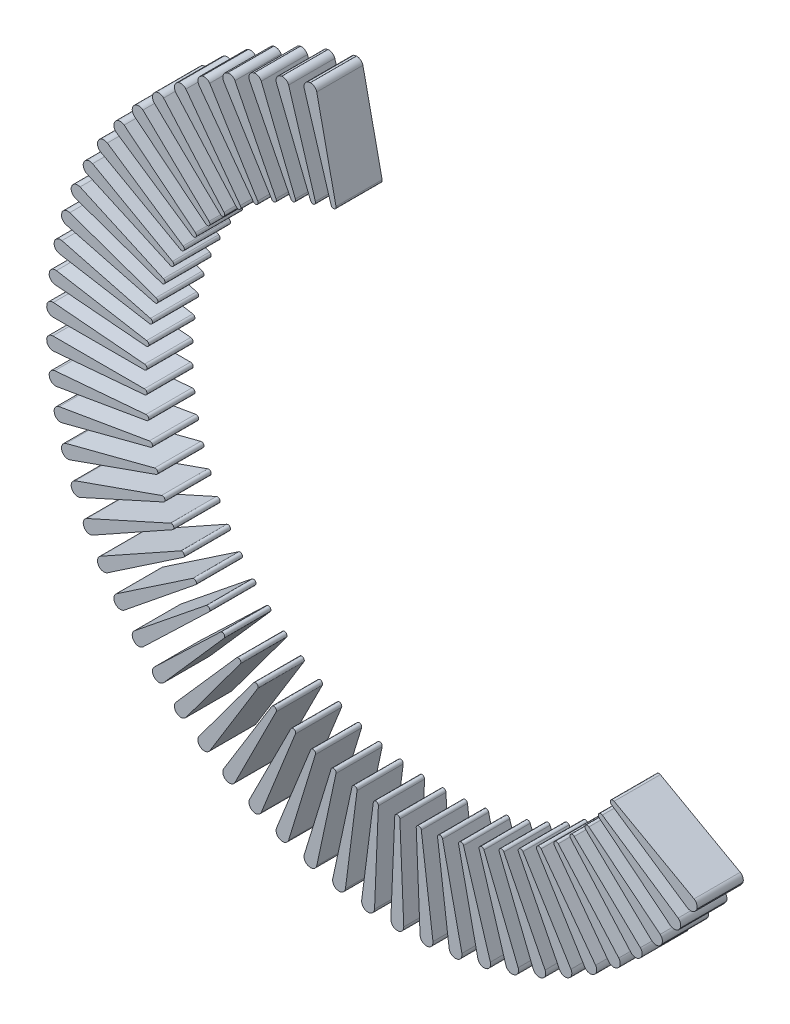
SolidWorks part; units mm, degrees
ref_plane "Přední rovina" through (0, 0, 0) normal (0, 0, 1) x (1, 0, 0)
ref_plane "Horní rovina" through (0, 0, 0) normal (0, 1, 0) x (1, 0, 0)
ref_plane "Pravá rovina" through (0, 0, 0) normal (1, 0, 0) x (0, 0, -1)
sketch "Skica1" plane through (0, 0, 0) normal (0, 0, 1) x (1, 0, 0)
  line L0 (-0.0007, 94.0554) -> (-0.0007, -97.5291) construction
  line L1 (-111.4898, -0.3887) -> (131.9321, -0.3887) construction
  line L2 (-0.0007, 77.5113) -> (-0.0007, 75.987)
  line L3 (-0.3207, 75.987) -> (0.3193, 75.987)
  line L4 (0.3193, 75.987) -> (0.3193, 75.977)
  line L5 (-0.0007, 76.0441) -> (-0.0007, 74.6141)
  line L6 (-0.0007, 74.6141) -> (-0.0007, 54.8141)
  line L7 (1.3993, 74.6141) -> (0.5493, 54.8141)
  line L8 (-1.4007, 74.6141) -> (-0.5507, 54.8141)
  line L9 (-0.3207, 75.987) -> (-0.3207, 75.977)
  line L10 (4.9321, 74.4641) -> (4.0999, 54.6633)
  line L11 (7.722, 74.2266) -> (5.1959, 54.57)
  line L12 (6.7623, 75.6862) -> (6.7615, 75.6762)
  line L13 (6.1246, 75.7405) -> (6.1238, 75.7305)
  line L14 (6.1246, 75.7405) -> (6.7623, 75.6862)
  line L15 (11.2293, 73.7776) -> (8.7209, 54.1187)
  line L16 (13.989, 73.3044) -> (9.8051, 53.9328)
  line L17 (13.1566, 74.8401) -> (13.1549, 74.8302)
  line L18 (12.5258, 74.9482) -> (12.5241, 74.9384)
  line L19 (12.5258, 74.9482) -> (13.1566, 74.8401)
  line L20 (17.4456, 72.5595) -> (13.279, 53.1842)
  line L21 (20.1553, 71.8539) -> (14.3436, 52.907)
  line L22 (19.4561, 73.4547) -> (19.4536, 73.445)
  line L23 (18.8367, 73.616) -> (18.8342, 73.6063)
  line L24 (18.8367, 73.616) -> (19.4561, 73.4547)
  line L25 (23.5363, 70.8186) -> (17.7415, 51.8664)
  line L26 (26.1763, 69.8858) -> (18.7787, 51.5)
  line L27 (25.6154, 71.5401) -> (25.6121, 71.5307)
  line L28 (25.012, 71.7533) -> (25.0086, 71.7439)
  line L29 (25.012, 71.7533) -> (25.6154, 71.5401)
  line L30 (29.4573, 68.5674) -> (22.0762, 50.175)
  line L31 (32.0087, 67.4141) -> (23.0786, 49.7219)
  line L32 (31.5901, 69.11) -> (31.586, 69.1009)
  line L33 (31.007, 69.3736) -> (31.0028, 69.3645)
  line L34 (31.007, 69.3736) -> (31.5901, 69.11)
  line L35 (35.1661, 65.8223) -> (26.2518, 48.122)
  line L36 (37.6106, 64.4567) -> (27.2121, 47.5856)
  line L37 (37.3373, 66.182) -> (37.3324, 66.1733)
  line L38 (36.7785, 66.4941) -> (36.7737, 66.4854)
  line L39 (36.7785, 66.4941) -> (37.3373, 66.182)
  line L40 (40.6215, 62.6028) -> (30.2383, 45.7224)
  line L41 (42.9414, 61.0349) -> (31.1496, 45.1064)
  line L42 (42.8154, 62.7772) -> (42.8098, 62.7689)
  line L43 (42.2851, 63.1356) -> (42.2795, 63.1273)
  line L44 (42.2851, 63.1356) -> (42.8154, 62.7772)
  line L45 (45.7843, 58.9324) -> (34.0069, 42.9933)
  line L46 (47.9628, 57.1733) -> (34.8627, 42.3022)
  line L47 (47.985, 58.92) -> (47.9787, 58.9122)
  line L48 (47.4871, 59.3221) -> (47.4808, 59.3143)
  line L49 (47.4871, 59.3221) -> (47.985, 58.92)
  line L50 (50.6172, 54.8373) -> (37.5304, 39.9544)
  line L51 (52.6386, 52.8999) -> (38.3246, 39.1933)
  line L52 (52.8089, 54.6383) -> (52.802, 54.6311)
  line L53 (52.3469, 55.0812) -> (52.34, 55.074)
  line L54 (52.3469, 55.0812) -> (52.8089, 54.6383)
  line L55 (55.0853, 50.3471) -> (40.7836, 36.6277)
  line L56 (56.9352, 48.2452) -> (41.5104, 35.8019)
  line L57 (57.2523, 49.963) -> (57.2448, 49.9564)
  line L58 (56.8295, 50.4434) -> (56.822, 50.4368)
  line L59 (56.8295, 50.4434) -> (57.2523, 49.963)
  line L60 (59.1566, 45.4942) -> (43.7429, 33.037)
  line L61 (60.8216, 43.243) -> (44.397, 32.1526)
  line L62 (61.2832, 44.9277) -> (61.2752, 44.9217)
  line L63 (60.9027, 45.4422) -> (60.8946, 45.4363)
  line L64 (60.9027, 45.4422) -> (61.2832, 44.9277)
  line L65 (62.8017, 40.3134) -> (46.3871, 29.2083)
  line L66 (64.2698, 37.9291) -> (46.9638, 28.2717)
  line L67 (64.8726, 39.5686) -> (64.8641, 39.5634)
  line L68 (64.537, 40.1136) -> (64.5285, 40.1084)
  line L69 (64.537, 40.1136) -> (64.8726, 39.5686)
  line L70 (65.9943, 34.8422) -> (48.697, 25.1692)
  line L71 (67.2548, 32.342) -> (49.1922, 24.187)
  line L72 (67.9946, 33.9245) -> (67.9856, 33.92)
  line L73 (67.7064, 34.496) -> (67.6975, 34.4915)
  line L74 (67.7064, 34.496) -> (67.9946, 33.9245)
  line L75 (68.7114, 29.12) -> (50.6561, 20.9488)
  line L76 (69.7554, 26.5219) -> (51.0662, 19.9281)
  line L77 (70.6266, 28.036) -> (70.6173, 28.0322)
  line L78 (70.388, 28.6298) -> (70.3787, 28.6261)
  line L79 (70.388, 28.6298) -> (70.6266, 28.036)
  line L80 (70.9334, 23.188) -> (52.2502, 16.5773)
  line L81 (71.7533, 20.5107) -> (52.5723, 15.5256)
  line L82 (72.7498, 21.9454) -> (72.7402, 21.9425)
  line L83 (72.5624, 22.5573) -> (72.5528, 22.5544)
  line L84 (72.5624, 22.5573) -> (72.7498, 21.9454)
  line L85 (72.6443, 17.0889) -> (53.4678, 12.0865)
  line L86 (73.2342, 14.3517) -> (53.6995, 11.0112)
  line L87 (74.3488, 15.6967) -> (74.339, 15.6946)
  line L88 (74.214, 16.3224) -> (74.2042, 16.3203)
  line L89 (74.214, 16.3224) -> (74.3488, 15.6967)
  line L90 (73.8318, 10.8666) -> (54.3002, 7.5086)
  line L91 (74.1875, 8.0893) -> (54.4399, 6.4175)
  line L92 (75.4121, 9.335) -> (75.4022, 9.3337)
  line L93 (75.3308, 9.9698) -> (75.3209, 9.9685)
  line L94 (75.3308, 9.9698) -> (75.4121, 9.335)
  line L95 (74.4874, 4.5661) -> (54.7413, 2.8766)
  line L96 (74.6063, 1.7686) -> (54.788, 1.7775)
  line L97 (75.9321, 2.9059) -> (75.9221, 2.9055)
  line L98 (75.905, 3.5454) -> (75.895, 3.5449)
  line L99 (75.905, 3.5454) -> (75.9321, 2.9059)
  line L100 (74.6063, -1.7673) -> (54.7881, -1.7762)
  line L101 (74.4875, -4.5648) -> (54.7414, -2.8752)
  line L102 (75.905, -3.544) -> (75.895, -3.5436)
  line L103 (75.9322, -2.9046) -> (75.9222, -2.9042)
  line L104 (75.9322, -2.9046) -> (75.905, -3.544)
  line L105 (74.1877, -8.088) -> (54.4401, -6.4162)
  line L106 (73.832, -10.8653) -> (54.3004, -7.5072)
  line L107 (75.331, -9.9685) -> (75.3211, -9.9672)
  line L108 (75.4123, -9.3336) -> (75.4024, -9.3324)
  line L109 (75.4123, -9.3336) -> (75.331, -9.9685)
  line L110 (73.2345, -14.3504) -> (53.6998, -11.0099)
  line L111 (72.6446, -17.0876) -> (53.4681, -12.0852)
  line L112 (74.2142, -16.3211) -> (74.2045, -16.3189)
  line L113 (74.3491, -15.6954) -> (74.3393, -15.6933)
  line L114 (74.3491, -15.6954) -> (74.2142, -16.3211)
  line L115 (71.7537, -20.5094) -> (52.5727, -15.5243)
  line L116 (70.9338, -23.1867) -> (52.2506, -16.5761)
  line L117 (72.5628, -22.5561) -> (72.5532, -22.5531)
  line L118 (72.7502, -21.9441) -> (72.7406, -21.9412)
  line L119 (72.7502, -21.9441) -> (72.5628, -22.5561)
  line L120 (69.7559, -26.5207) -> (51.0667, -19.9268)
  line L121 (68.7119, -29.1188) -> (50.6566, -20.9475)
  line L122 (70.3885, -28.6286) -> (70.3792, -28.6248)
  line L123 (70.6271, -28.0347) -> (70.6178, -28.031)
  line L124 (70.6271, -28.0347) -> (70.3885, -28.6286)
  line L125 (67.2554, -32.3409) -> (49.1928, -24.1858)
  line L126 (65.9949, -34.841) -> (48.6976, -25.168)
  line L127 (67.707, -34.4948) -> (67.6981, -34.4903)
  line L128 (67.9952, -33.9233) -> (67.9862, -33.9188)
  line L129 (67.9952, -33.9233) -> (67.707, -34.4948)
  line L130 (64.2705, -37.928) -> (46.9645, -28.2705)
  line L131 (62.8024, -40.3123) -> (46.3878, -29.2072)
  line L132 (64.5377, -40.1125) -> (64.5292, -40.1072)
  line L133 (64.8733, -39.5675) -> (64.8648, -39.5623)
  line L134 (64.8733, -39.5675) -> (64.5377, -40.1125)
  line L135 (60.8224, -43.2419) -> (44.3978, -32.1515)
  line L136 (59.1574, -45.4931) -> (43.7437, -33.0359)
  line L137 (60.9035, -45.4412) -> (60.8954, -45.4352)
  line L138 (61.284, -44.9266) -> (61.276, -44.9206)
  line L139 (61.284, -44.9266) -> (60.9035, -45.4412)
  line L140 (56.9361, -48.2442) -> (41.5112, -35.8009)
  line L141 (55.0862, -50.3461) -> (40.7845, -36.6267)
  line L142 (56.8304, -50.4424) -> (56.8229, -50.4358)
  line L143 (57.2532, -49.962) -> (57.2457, -49.9554)
  line L144 (57.2532, -49.962) -> (56.8304, -50.4424)
  line L145 (52.6396, -52.8989) -> (38.3256, -39.1923)
  line L146 (50.6181, -54.8364) -> (37.5314, -39.9535)
  line L147 (52.3478, -55.0803) -> (52.3409, -55.073)
  line L148 (52.8099, -54.6374) -> (52.803, -54.6302)
  line L149 (52.8099, -54.6374) -> (52.3478, -55.0803)
  line L150 (47.9638, -57.1725) -> (34.8638, -42.3014)
  line L151 (45.7853, -58.9315) -> (34.0079, -42.9924)
  line L152 (47.4881, -59.3212) -> (47.4818, -59.3135)
  line L153 (47.9861, -58.9192) -> (47.9798, -58.9114)
  line L154 (47.9861, -58.9192) -> (47.4881, -59.3212)
  line L155 (42.9425, -61.0342) -> (31.1507, -45.1056)
  line L156 (40.6227, -62.6021) -> (30.2394, -45.7216)
  line L157 (42.2863, -63.1348) -> (42.2807, -63.1265)
  line L158 (42.8165, -62.7764) -> (42.8109, -62.7681)
  line L159 (42.8165, -62.7764) -> (42.2863, -63.1348)
  line L160 (37.6117, -64.4561) -> (27.2133, -47.5849)
  line L161 (35.1673, -65.8216) -> (26.253, -48.1214)
  line L162 (36.7797, -66.4935) -> (36.7748, -66.4848)
  line L163 (37.3384, -66.1814) -> (37.3336, -66.1726)
  line L164 (37.3384, -66.1814) -> (36.7797, -66.4935)
  line L165 (32.01, -67.4136) -> (23.0798, -49.7213)
  line L166 (29.4585, -68.5669) -> (22.0774, -50.1744)
  line L167 (31.0082, -69.3731) -> (31.0041, -69.364)
  line L168 (31.5914, -69.1095) -> (31.5872, -69.1004)
  line L169 (31.5914, -69.1095) -> (31.0082, -69.3731)
  line L170 (26.1776, -69.8853) -> (18.78, -51.4995)
  line L171 (23.5375, -70.8181) -> (17.7428, -51.866)
  line L172 (25.0132, -71.7528) -> (25.0099, -71.7434)
  line L173 (25.6167, -71.5396) -> (25.6133, -71.5302)
  line L174 (25.6167, -71.5396) -> (25.0132, -71.7528)
  line L175 (20.1566, -71.8536) -> (14.3449, -52.9067)
  line L176 (17.4469, -72.5591) -> (13.2803, -53.1838)
  line L177 (18.838, -73.6156) -> (18.8355, -73.6059)
  line L178 (19.4574, -73.4544) -> (19.4549, -73.4447)
  line L179 (19.4574, -73.4544) -> (18.838, -73.6156)
  line L180 (13.9904, -73.3041) -> (9.8064, -53.9326)
  line L181 (11.2306, -73.7773) -> (8.7222, -54.1185)
  line L182 (12.5271, -74.948) -> (12.5254, -74.9381)
  line L183 (13.1579, -74.8398) -> (13.1562, -74.83)
  line L184 (13.1579, -74.8398) -> (12.5271, -74.948)
  line L185 (7.7233, -74.2265) -> (5.1972, -54.5699)
  line L186 (4.9334, -74.464) -> (4.1012, -54.6632)
  line L187 (6.126, -75.7404) -> (6.1251, -75.7304)
  line L188 (6.7637, -75.6861) -> (6.7628, -75.6761)
  line L189 (6.7637, -75.6861) -> (6.126, -75.7404)
  line L190 (1.4007, -74.6141) -> (0.5507, -54.8141)
  line L191 (-1.3993, -74.6141) -> (-0.5493, -54.8141)
  line L192 (-0.3193, -75.987) -> (-0.3193, -75.977)
  line L193 (0.3207, -75.987) -> (0.3207, -75.977)
  line L194 (0.3207, -75.987) -> (-0.3193, -75.987)
  line L195 (-4.9321, -74.4641) -> (-4.0999, -54.6633)
  line L196 (-7.722, -74.2266) -> (-5.1959, -54.57)
  line L197 (-6.7623, -75.6862) -> (-6.7615, -75.6762)
  line L198 (-6.1246, -75.7405) -> (-6.1238, -75.7305)
  line L199 (-6.1246, -75.7405) -> (-6.7623, -75.6862)
  line L200 (-11.2293, -73.7776) -> (-8.7209, -54.1187)
  line L201 (-13.989, -73.3044) -> (-9.8051, -53.9328)
  line L202 (-13.1566, -74.8401) -> (-13.1549, -74.8302)
  line L203 (-12.5258, -74.9482) -> (-12.5241, -74.9384)
  line L204 (-12.5258, -74.9482) -> (-13.1566, -74.8401)
  line L205 (-17.4456, -72.5595) -> (-13.279, -53.1842)
  line L206 (-20.1553, -71.8539) -> (-14.3436, -52.907)
  line L207 (-19.4561, -73.4547) -> (-19.4536, -73.445)
  line L208 (-18.8367, -73.616) -> (-18.8342, -73.6063)
  line L209 (-18.8367, -73.616) -> (-19.4561, -73.4547)
  line L210 (-23.5363, -70.8186) -> (-17.7415, -51.8664)
  line L211 (-26.1763, -69.8858) -> (-18.7787, -51.5)
  line L212 (-25.6154, -71.5401) -> (-25.6121, -71.5307)
  line L213 (-25.012, -71.7533) -> (-25.0086, -71.7439)
  line L214 (-25.012, -71.7533) -> (-25.6154, -71.5401)
  line L215 (-29.4573, -68.5674) -> (-22.0762, -50.175)
  line L216 (-32.0087, -67.4141) -> (-23.0786, -49.7219)
  line L217 (-31.5901, -69.11) -> (-31.586, -69.1009)
  line L218 (-31.007, -69.3736) -> (-31.0028, -69.3645)
  line L219 (-31.007, -69.3736) -> (-31.5901, -69.11)
  line L220 (-35.1661, -65.8223) -> (-26.2518, -48.122)
  line L221 (-37.6106, -64.4567) -> (-27.2121, -47.5856)
  line L222 (-37.3373, -66.182) -> (-37.3324, -66.1733)
  line L223 (-36.7785, -66.4941) -> (-36.7737, -66.4854)
  line L224 (-36.7785, -66.4941) -> (-37.3373, -66.182)
  line L225 (-40.6215, -62.6028) -> (-30.2383, -45.7224)
  line L226 (-42.9414, -61.0349) -> (-31.1496, -45.1064)
  line L227 (-42.8154, -62.7772) -> (-42.8098, -62.7689)
  line L228 (-42.2851, -63.1356) -> (-42.2795, -63.1273)
  line L229 (-42.2851, -63.1356) -> (-42.8154, -62.7772)
  line L230 (-45.7843, -58.9324) -> (-34.0069, -42.9933)
  line L231 (-47.9628, -57.1733) -> (-34.8627, -42.3022)
  line L232 (-47.985, -58.92) -> (-47.9787, -58.9122)
  line L233 (-47.4871, -59.3221) -> (-47.4808, -59.3143)
  line L234 (-47.4871, -59.3221) -> (-47.985, -58.92)
  line L235 (-50.6172, -54.8373) -> (-37.5304, -39.9544)
  line L236 (-52.6386, -52.8999) -> (-38.3246, -39.1933)
  line L237 (-52.8089, -54.6383) -> (-52.802, -54.6311)
  line L238 (-52.3469, -55.0812) -> (-52.34, -55.074)
  line L239 (-52.3469, -55.0812) -> (-52.8089, -54.6383)
  line L240 (-55.0853, -50.3471) -> (-40.7836, -36.6277)
  line L241 (-56.9352, -48.2452) -> (-41.5104, -35.8019)
  line L242 (-57.2523, -49.963) -> (-57.2448, -49.9564)
  line L243 (-56.8295, -50.4434) -> (-56.822, -50.4368)
  line L244 (-56.8295, -50.4434) -> (-57.2523, -49.963)
  line L245 (-59.1566, -45.4942) -> (-43.7429, -33.037)
  line L246 (-60.8216, -43.243) -> (-44.397, -32.1526)
  line L247 (-61.2832, -44.9277) -> (-61.2752, -44.9217)
  line L248 (-60.9027, -45.4422) -> (-60.8946, -45.4363)
  line L249 (-60.9027, -45.4422) -> (-61.2832, -44.9277)
  line L250 (-62.8017, -40.3134) -> (-46.3871, -29.2083)
  line L251 (-64.2698, -37.9291) -> (-46.9638, -28.2717)
  line L252 (-64.8726, -39.5686) -> (-64.8641, -39.5634)
  line L253 (-64.537, -40.1136) -> (-64.5285, -40.1084)
  line L254 (-64.537, -40.1136) -> (-64.8726, -39.5686)
  line L255 (-65.9943, -34.8422) -> (-48.697, -25.1692)
  line L256 (-67.2548, -32.342) -> (-49.1922, -24.187)
  line L257 (-67.9946, -33.9245) -> (-67.9856, -33.92)
  line L258 (-67.7064, -34.496) -> (-67.6975, -34.4915)
  line L259 (-67.7064, -34.496) -> (-67.9946, -33.9245)
  line L260 (-68.7114, -29.12) -> (-50.6561, -20.9488)
  line L261 (-69.7554, -26.5219) -> (-51.0662, -19.9281)
  line L262 (-70.6266, -28.036) -> (-70.6173, -28.0322)
  line L263 (-70.388, -28.6298) -> (-70.3787, -28.6261)
  line L264 (-70.388, -28.6298) -> (-70.6266, -28.036)
  line L265 (-70.9334, -23.188) -> (-52.2502, -16.5773)
  line L266 (-71.7533, -20.5107) -> (-52.5723, -15.5256)
  line L267 (-72.7498, -21.9454) -> (-72.7402, -21.9425)
  line L268 (-72.5624, -22.5573) -> (-72.5528, -22.5544)
  line L269 (-72.5624, -22.5573) -> (-72.7498, -21.9454)
  line L270 (-72.6443, -17.0889) -> (-53.4678, -12.0865)
  line L271 (-73.2342, -14.3517) -> (-53.6995, -11.0112)
  line L272 (-74.3488, -15.6967) -> (-74.339, -15.6946)
  line L273 (-74.214, -16.3224) -> (-74.2042, -16.3203)
  line L274 (-74.214, -16.3224) -> (-74.3488, -15.6967)
  line L275 (-73.8318, -10.8666) -> (-54.3002, -7.5086)
  line L276 (-74.1875, -8.0893) -> (-54.4399, -6.4175)
  line L277 (-75.4121, -9.335) -> (-75.4022, -9.3337)
  line L278 (-75.3308, -9.9698) -> (-75.3209, -9.9685)
  line L279 (-75.3308, -9.9698) -> (-75.4121, -9.335)
  line L280 (-74.4874, -4.5661) -> (-54.7413, -2.8766)
  line L281 (-74.6063, -1.7686) -> (-54.788, -1.7775)
  line L282 (-75.9321, -2.9059) -> (-75.9221, -2.9055)
  line L283 (-75.905, -3.5454) -> (-75.895, -3.5449)
  line L284 (-75.905, -3.5454) -> (-75.9321, -2.9059)
  line L285 (-74.6063, 1.7673) -> (-54.7881, 1.7762)
  line L286 (-74.4875, 4.5648) -> (-54.7414, 2.8752)
  line L287 (-75.905, 3.544) -> (-75.895, 3.5436)
  line L288 (-75.9322, 2.9046) -> (-75.9222, 2.9042)
  line L289 (-75.9322, 2.9046) -> (-75.905, 3.544)
  line L290 (-74.1877, 8.088) -> (-54.4401, 6.4162)
  line L291 (-73.832, 10.8653) -> (-54.3004, 7.5072)
  line L292 (-75.331, 9.9685) -> (-75.3211, 9.9672)
  line L293 (-75.4123, 9.3336) -> (-75.4024, 9.3324)
  line L294 (-75.4123, 9.3336) -> (-75.331, 9.9685)
  line L295 (-73.2345, 14.3504) -> (-53.6998, 11.0099)
  line L296 (-72.6446, 17.0876) -> (-53.4681, 12.0852)
  line L297 (-74.2142, 16.3211) -> (-74.2045, 16.3189)
  line L298 (-74.3491, 15.6954) -> (-74.3393, 15.6933)
  line L299 (-74.3491, 15.6954) -> (-74.2142, 16.3211)
  line L300 (-71.7537, 20.5094) -> (-52.5727, 15.5243)
  line L301 (-70.9338, 23.1867) -> (-52.2506, 16.5761)
  line L302 (-72.5628, 22.5561) -> (-72.5532, 22.5531)
  line L303 (-72.7502, 21.9441) -> (-72.7406, 21.9412)
  line L304 (-72.7502, 21.9441) -> (-72.5628, 22.5561)
  line L305 (-69.7559, 26.5207) -> (-51.0667, 19.9268)
  line L306 (-68.7119, 29.1188) -> (-50.6566, 20.9475)
  line L307 (-70.3885, 28.6286) -> (-70.3792, 28.6248)
  line L308 (-70.6271, 28.0347) -> (-70.6178, 28.031)
  line L309 (-70.6271, 28.0347) -> (-70.3885, 28.6286)
  line L310 (-67.2554, 32.3409) -> (-49.1928, 24.1858)
  line L311 (-65.9949, 34.841) -> (-48.6976, 25.168)
  line L312 (-67.707, 34.4948) -> (-67.6981, 34.4903)
  line L313 (-67.9952, 33.9233) -> (-67.9862, 33.9188)
  line L314 (-67.9952, 33.9233) -> (-67.707, 34.4948)
  line L315 (-64.2705, 37.928) -> (-46.9645, 28.2705)
  line L316 (-62.8024, 40.3123) -> (-46.3878, 29.2072)
  line L317 (-64.5377, 40.1125) -> (-64.5292, 40.1072)
  line L318 (-64.8733, 39.5675) -> (-64.8648, 39.5623)
  line L319 (-64.8733, 39.5675) -> (-64.5377, 40.1125)
  line L320 (-60.8224, 43.2419) -> (-44.3978, 32.1515)
  line L321 (-59.1574, 45.4931) -> (-43.7437, 33.0359)
  line L322 (-60.9035, 45.4412) -> (-60.8954, 45.4352)
  line L323 (-61.284, 44.9266) -> (-61.276, 44.9206)
  line L324 (-61.284, 44.9266) -> (-60.9035, 45.4412)
  line L325 (-56.9361, 48.2442) -> (-41.5112, 35.8009)
  line L326 (-55.0862, 50.3461) -> (-40.7845, 36.6267)
  line L327 (-56.8304, 50.4424) -> (-56.8229, 50.4358)
  line L328 (-57.2532, 49.962) -> (-57.2457, 49.9554)
  line L329 (-57.2532, 49.962) -> (-56.8304, 50.4424)
  line L330 (-52.6396, 52.8989) -> (-38.3256, 39.1923)
  line L331 (-50.6181, 54.8364) -> (-37.5314, 39.9535)
  line L332 (-52.3478, 55.0803) -> (-52.3409, 55.073)
  line L333 (-52.8099, 54.6374) -> (-52.803, 54.6302)
  line L334 (-52.8099, 54.6374) -> (-52.3478, 55.0803)
  line L335 (-47.9638, 57.1725) -> (-34.8638, 42.3014)
  line L336 (-45.7853, 58.9315) -> (-34.0079, 42.9924)
  line L337 (-47.4881, 59.3212) -> (-47.4818, 59.3135)
  line L338 (-47.9861, 58.9192) -> (-47.9798, 58.9114)
  line L339 (-47.9861, 58.9192) -> (-47.4881, 59.3212)
  line L340 (-42.9425, 61.0342) -> (-31.1507, 45.1056)
  line L341 (-40.6227, 62.6021) -> (-30.2394, 45.7216)
  line L342 (-42.2863, 63.1348) -> (-42.2807, 63.1265)
  line L343 (-42.8165, 62.7764) -> (-42.8109, 62.7681)
  line L344 (-42.8165, 62.7764) -> (-42.2863, 63.1348)
  line L345 (-37.6117, 64.4561) -> (-27.2133, 47.5849)
  line L346 (-35.1673, 65.8216) -> (-26.253, 48.1214)
  line L347 (-36.7797, 66.4935) -> (-36.7748, 66.4848)
  line L348 (-37.3384, 66.1814) -> (-37.3336, 66.1726)
  line L349 (-37.3384, 66.1814) -> (-36.7797, 66.4935)
  line L350 (-32.01, 67.4136) -> (-23.0798, 49.7213)
  line L351 (-29.4585, 68.5669) -> (-22.0774, 50.1744)
  line L352 (-31.0082, 69.3731) -> (-31.0041, 69.364)
  line L353 (-31.5914, 69.1095) -> (-31.5872, 69.1004)
  line L354 (-31.5914, 69.1095) -> (-31.0082, 69.3731)
  line L355 (-26.1776, 69.8853) -> (-18.78, 51.4995)
  line L356 (-23.5375, 70.8181) -> (-17.7428, 51.866)
  line L357 (-25.0132, 71.7528) -> (-25.0099, 71.7434)
  line L358 (-25.6167, 71.5396) -> (-25.6133, 71.5302)
  line L359 (-25.6167, 71.5396) -> (-25.0132, 71.7528)
  line L360 (-20.1566, 71.8536) -> (-14.3449, 52.9067)
  line L361 (-17.4469, 72.5591) -> (-13.2803, 53.1838)
  line L362 (-18.838, 73.6156) -> (-18.8355, 73.6059)
  line L363 (-19.4574, 73.4544) -> (-19.4549, 73.4447)
  line L364 (-19.4574, 73.4544) -> (-18.838, 73.6156)
  line L365 (-13.9904, 73.3041) -> (-9.8064, 53.9326)
  line L366 (-11.2306, 73.7773) -> (-8.7222, 54.1185)
  line L367 (-12.5271, 74.948) -> (-12.5254, 74.9381)
  line L368 (-13.1579, 74.8398) -> (-13.1562, 74.83)
  line L369 (-13.1579, 74.8398) -> (-12.5271, 74.948)
  line L370 (-7.7233, 74.2265) -> (-5.1972, 54.5699)
  line L371 (-4.9334, 74.464) -> (-4.1012, 54.6632)
  line L372 (-6.126, 75.7404) -> (-6.1251, 75.7304)
  line L373 (-6.7637, 75.6861) -> (-6.7628, 75.6761)
  line L374 (-6.7637, 75.6861) -> (-6.126, 75.7404)
  circle A0 centre (-0.0007, -0.3887) radius 25
  circle A1 centre (-0.0007, -0.3887) radius 77.9
  arc A2 (1.3942, 74.4941) -> (0.3193, 75.977) centre (-0.0007, 74.6141) ccw
  arc A3 (-0.5507, 54.8141) -> (0.5493, 54.8141) centre (-0.0007, 54.8141) ccw
  arc A4 (-0.3207, 75.977) -> (-1.3955, 74.4941) centre (-0.0007, 74.6141) ccw
  arc A5 (4.0999, 54.6633) -> (5.1959, 54.57) centre (4.6479, 54.6167) ccw
  arc A6 (6.1238, 75.7305) -> (4.927, 74.3441) centre (6.327, 74.3454) ccw
  arc A7 (7.7067, 74.1075) -> (6.7615, 75.6762) centre (6.327, 74.3454) ccw
  arc A8 (8.7209, 54.1187) -> (9.8051, 53.9328) centre (9.263, 54.0258) ccw
  arc A9 (12.5241, 74.9384) -> (11.2141, 73.6584) centre (12.6092, 73.541) ccw
  arc A10 (13.9637, 73.187) -> (13.1549, 74.8302) centre (12.6092, 73.541) ccw
  arc A11 (13.279, 53.1842) -> (14.3436, 52.907) centre (13.8113, 53.0456) ccw
  arc A12 (18.8342, 73.6063) -> (17.4204, 72.4421) centre (18.8005, 72.2067) ccw
  arc A13 (20.1201, 71.7391) -> (19.4536, 73.445) centre (18.8005, 72.2067) ccw
  arc A14 (17.7415, 51.8664) -> (18.7787, 51.5) centre (18.2601, 51.6832) ccw
  arc A15 (25.0086, 71.7439) -> (23.5012, 70.7037) centre (24.8563, 70.3522) ccw
  arc A16 (26.1315, 69.7744) -> (25.6121, 71.5307) centre (24.8563, 70.3522) ccw
  arc A17 (22.0762, 50.175) -> (23.0786, 49.7219) centre (22.5774, 49.9484) ccw
  arc A18 (31.0028, 69.3645) -> (29.4126, 68.456) centre (30.733, 67.9908) ccw
  arc A19 (31.9546, 67.3069) -> (31.586, 69.1009) centre (30.733, 67.9908) ccw
  arc A20 (26.2518, 48.122) -> (27.2121, 47.5856) centre (26.732, 47.8538) ccw
  arc A21 (36.7737, 66.4854) -> (35.1121, 65.715) centre (36.3883, 65.1395) ccw
  arc A22 (37.5475, 64.3545) -> (37.3324, 66.1733) centre (36.3883, 65.1395) ccw
  arc A23 (30.2383, 45.7224) -> (31.1496, 45.1064) centre (30.694, 45.4144) ccw
  arc A24 (42.2795, 63.1273) -> (40.5586, 62.5005) centre (41.7815, 61.8189) ccw
  arc A25 (42.8699, 60.9384) -> (42.8098, 62.7689) centre (41.7815, 61.8189) ccw
  arc A26 (34.0069, 42.9933) -> (34.8627, 42.3022) centre (34.4348, 42.6477) ccw
  arc A27 (47.4808, 59.3143) -> (45.7129, 58.8358) centre (46.8735, 58.0529) ccw
  arc A28 (47.8834, 57.0832) -> (47.9787, 58.9122) centre (46.8735, 58.0529) ccw
  arc A29 (37.5304, 39.9544) -> (38.3246, 39.1933) centre (37.9275, 39.5738) ccw
  arc A30 (52.34, 55.074) -> (50.5379, 54.7471) centre (51.6279, 53.8686) ccw
  arc A31 (52.5519, 52.8168) -> (52.802, 54.6311) centre (51.6279, 53.8686) ccw
  arc A32 (40.7836, 36.6277) -> (41.5104, 35.8019) centre (41.147, 36.2148) ccw
  arc A33 (56.822, 50.4368) -> (54.9987, 50.264) centre (56.0103, 49.2962) ccw
  arc A34 (56.8418, 48.1698) -> (57.2448, 49.9564) centre (56.0103, 49.2962) ccw
  arc A35 (43.7429, 33.037) -> (44.397, 32.1526) centre (44.07, 32.5948) ccw
  arc A36 (60.8946, 45.4363) -> (59.0632, 45.4187) centre (59.9891, 44.3686) ccw
  arc A37 (60.7221, 43.1758) -> (61.2752, 44.9217) centre (59.9891, 44.3686) ccw
  arc A38 (46.3871, 29.2083) -> (46.9638, 28.2717) centre (46.6754, 28.74) ccw
  arc A39 (64.5285, 40.1084) -> (62.7022, 40.2461) centre (63.5357, 39.1213) ccw
  arc A40 (64.1649, 37.8706) -> (64.8641, 39.5634) centre (63.5357, 39.1213) ccw
  arc A41 (48.697, 25.1692) -> (49.1922, 24.187) centre (48.9446, 24.6781) ccw
  arc A42 (67.6975, 34.4915) -> (65.8895, 34.7836) centre (66.6246, 33.5921) ccw
  arc A43 (67.1454, 32.2926) -> (67.9856, 33.92) centre (66.6246, 33.5921) ccw
  arc A44 (50.6561, 20.9488) -> (51.0662, 19.9281) centre (50.8611, 20.4384) ccw
  arc A45 (70.3787, 28.6261) -> (68.6019, 29.0705) centre (69.2334, 27.821) ccw
  arc A46 (69.6421, 26.482) -> (70.6173, 28.0322) centre (69.2334, 27.821) ccw
  arc A47 (52.2502, 16.5773) -> (52.5723, 15.5256) centre (52.4112, 16.0515) ccw
  arc A48 (72.5528, 22.5544) -> (70.8202, 23.1479) centre (71.3433, 21.8493) ccw
  arc A49 (71.637, 20.4805) -> (72.7402, 21.9425) centre (71.3433, 21.8493) ccw
  arc A50 (53.4678, 12.0865) -> (53.6995, 11.0112) centre (53.5837, 11.5488) ccw
  arc A51 (74.2042, 16.3203) -> (72.5281, 17.0586) centre (72.9393, 15.7203) ccw
  arc A52 (73.1158, 14.3315) -> (74.339, 15.6946) centre (72.9393, 15.7203) ccw
  arc A53 (54.3002, 7.5086) -> (54.4399, 6.4175) centre (54.37, 6.963) ccw
  arc A54 (75.3209, 9.9685) -> (73.7135, 10.8463) centre (74.0097, 9.478) ccw
  arc A55 (74.0678, 8.0792) -> (75.4022, 9.3337) centre (74.0097, 9.478) ccw
  arc A56 (54.7413, 2.8766) -> (54.788, 1.7775) centre (54.7647, 2.327) ccw
  arc A57 (75.895, 3.5449) -> (74.3678, 4.5559) centre (74.5468, 3.1674) ccw
  arc A58 (74.4862, 1.7687) -> (75.9221, 2.9055) centre (74.5468, 3.1674) ccw
  arc A59 (54.7881, -1.7762) -> (54.7414, -2.8752) centre (54.7647, -2.3257) ccw
  arc A60 (75.9222, -2.9042) -> (74.4862, -1.7674) centre (74.5469, -3.166) ccw
  arc A61 (74.3678, -4.5545) -> (75.895, -3.5436) centre (74.5469, -3.166) ccw
  arc A62 (54.4401, -6.4162) -> (54.3004, -7.5072) centre (54.3702, -6.9617) ccw
  arc A63 (75.4024, -9.3324) -> (74.068, -8.0779) centre (74.0098, -9.4767) ccw
  arc A64 (73.7137, -10.845) -> (75.3211, -9.9672) centre (74.0098, -9.4767) ccw
  arc A65 (53.6998, -11.0099) -> (53.4681, -12.0852) centre (53.5839, -11.5475) ccw
  arc A66 (74.3393, -15.6933) -> (73.1161, -14.3302) centre (72.9395, -15.719) ccw
  arc A67 (72.5284, -17.0573) -> (74.2045, -16.3189) centre (72.9395, -15.719) ccw
  arc A68 (52.5727, -15.5243) -> (52.2506, -16.5761) centre (52.4116, -16.0502) ccw
  arc A69 (72.7406, -21.9412) -> (71.6374, -20.4792) centre (71.3437, -21.8481) ccw
  arc A70 (70.8205, -23.1466) -> (72.5532, -22.5531) centre (71.3437, -21.8481) ccw
  arc A71 (51.0667, -19.9268) -> (50.6566, -20.9475) centre (50.8616, -20.4372) ccw
  arc A72 (70.6178, -28.031) -> (69.6426, -26.4807) centre (69.2339, -27.8197) ccw
  arc A73 (68.6024, -29.0693) -> (70.3792, -28.6248) centre (69.2339, -27.8197) ccw
  arc A74 (49.1928, -24.1858) -> (48.6976, -25.168) centre (48.9452, -24.6769) ccw
  arc A75 (67.9862, -33.9188) -> (67.146, -32.2914) centre (66.6252, -33.5909) ccw
  arc A76 (65.8901, -34.7824) -> (67.6981, -34.4903) centre (66.6252, -33.5909) ccw
  arc A77 (46.9645, -28.2705) -> (46.3878, -29.2072) centre (46.6762, -28.7389) ccw
  arc A78 (64.8648, -39.5623) -> (64.1656, -37.8695) centre (63.5364, -39.1201) ccw
  arc A79 (62.7029, -40.245) -> (64.5292, -40.1072) centre (63.5364, -39.1201) ccw
  arc A80 (44.3978, -32.1515) -> (43.7437, -33.0359) centre (44.0708, -32.5937) ccw
  arc A81 (61.276, -44.9206) -> (60.7229, -43.1747) centre (59.9899, -44.3675) ccw
  arc A82 (59.064, -45.4176) -> (60.8954, -45.4352) centre (59.9899, -44.3675) ccw
  arc A83 (41.5112, -35.8009) -> (40.7845, -36.6267) centre (41.1479, -36.2138) ccw
  arc A84 (57.2457, -49.9554) -> (56.8427, -48.1688) centre (56.0112, -49.2951) ccw
  arc A85 (54.9996, -50.263) -> (56.8229, -50.4358) centre (56.0112, -49.2951) ccw
  arc A86 (38.3256, -39.1923) -> (37.5314, -39.9535) centre (37.9285, -39.5729) ccw
  arc A87 (52.803, -54.6302) -> (52.5529, -52.8159) centre (51.6289, -53.8676) ccw
  arc A88 (50.5388, -54.7462) -> (52.3409, -55.073) centre (51.6289, -53.8676) ccw
  arc A89 (34.8638, -42.3014) -> (34.0079, -42.9924) centre (34.4358, -42.6469) ccw
  arc A90 (47.9798, -58.9114) -> (47.8845, -57.0824) centre (46.8746, -58.052) ccw
  arc A91 (45.714, -58.8349) -> (47.4818, -59.3135) centre (46.8746, -58.052) ccw
  arc A92 (31.1507, -45.1056) -> (30.2394, -45.7216) centre (30.6951, -45.4136) ccw
  arc A93 (42.8109, -62.7681) -> (42.871, -60.9376) centre (41.7826, -61.8181) ccw
  arc A94 (40.5597, -62.4998) -> (42.2807, -63.1265) centre (41.7826, -61.8181) ccw
  arc A95 (27.2133, -47.5849) -> (26.253, -48.1214) centre (26.7331, -47.8532) ccw
  arc A96 (37.3336, -66.1726) -> (37.5487, -64.3538) centre (36.3895, -65.1388) ccw
  arc A97 (35.1133, -65.7143) -> (36.7748, -66.4848) centre (36.3895, -65.1388) ccw
  arc A98 (23.0798, -49.7213) -> (22.0774, -50.1744) centre (22.5786, -49.9479) ccw
  arc A99 (31.5872, -69.1004) -> (31.9559, -67.3063) centre (30.7343, -67.9902) ccw
  arc A100 (29.4138, -68.4554) -> (31.0041, -69.364) centre (30.7343, -67.9902) ccw
  arc A101 (18.78, -51.4995) -> (17.7428, -51.866) centre (18.2614, -51.6828) ccw
  arc A102 (25.6133, -71.5302) -> (26.1328, -69.7739) centre (24.8576, -70.3517) ccw
  arc A103 (23.5024, -70.7033) -> (25.0099, -71.7434) centre (24.8576, -70.3517) ccw
  arc A104 (14.3449, -52.9067) -> (13.2803, -53.1838) centre (13.8126, -53.0452) ccw
  arc A105 (19.4549, -73.4447) -> (20.1214, -71.7388) centre (18.8018, -72.2064) ccw
  arc A106 (17.4217, -72.4417) -> (18.8355, -73.6059) centre (18.8018, -72.2064) ccw
  arc A107 (9.8064, -53.9326) -> (8.7222, -54.1185) centre (9.2643, -54.0255) ccw
  arc A108 (13.1562, -74.83) -> (13.965, -73.1867) centre (12.6105, -73.5407) ccw
  arc A109 (11.2154, -73.6582) -> (12.5254, -74.9381) centre (12.6105, -73.5407) ccw
  arc A110 (5.1972, -54.5699) -> (4.1012, -54.6632) centre (4.6492, -54.6166) ccw
  arc A111 (6.7628, -75.6761) -> (7.708, -74.1074) centre (6.3284, -74.3452) ccw
  arc A112 (4.9284, -74.344) -> (6.1251, -75.7304) centre (6.3284, -74.3452) ccw
  arc A113 (0.5507, -54.8141) -> (-0.5493, -54.8141) centre (0.0007, -54.8141) ccw
  arc A114 (0.3207, -75.977) -> (1.3955, -74.4941) centre (0.0007, -74.6141) ccw
  arc A115 (-1.3942, -74.4941) -> (-0.3193, -75.977) centre (0.0007, -74.6141) ccw
  arc A116 (-4.0999, -54.6633) -> (-5.1959, -54.57) centre (-4.6479, -54.6167) ccw
  arc A117 (-6.1238, -75.7305) -> (-4.927, -74.3441) centre (-6.327, -74.3454) ccw
  arc A118 (-7.7067, -74.1075) -> (-6.7615, -75.6762) centre (-6.327, -74.3454) ccw
  arc A119 (-8.7209, -54.1187) -> (-9.8051, -53.9328) centre (-9.263, -54.0258) ccw
  arc A120 (-12.5241, -74.9384) -> (-11.2141, -73.6584) centre (-12.6092, -73.541) ccw
  arc A121 (-13.9637, -73.187) -> (-13.1549, -74.8302) centre (-12.6092, -73.541) ccw
  arc A122 (-13.279, -53.1842) -> (-14.3436, -52.907) centre (-13.8113, -53.0456) ccw
  arc A123 (-18.8342, -73.6063) -> (-17.4204, -72.4421) centre (-18.8005, -72.2067) ccw
  arc A124 (-20.1201, -71.7391) -> (-19.4536, -73.445) centre (-18.8005, -72.2067) ccw
  arc A125 (-17.7415, -51.8664) -> (-18.7787, -51.5) centre (-18.2601, -51.6832) ccw
  arc A126 (-25.0086, -71.7439) -> (-23.5012, -70.7037) centre (-24.8563, -70.3522) ccw
  arc A127 (-26.1315, -69.7744) -> (-25.6121, -71.5307) centre (-24.8563, -70.3522) ccw
  arc A128 (-22.0762, -50.175) -> (-23.0786, -49.7219) centre (-22.5774, -49.9484) ccw
  arc A129 (-31.0028, -69.3645) -> (-29.4126, -68.456) centre (-30.733, -67.9908) ccw
  arc A130 (-31.9546, -67.3069) -> (-31.586, -69.1009) centre (-30.733, -67.9908) ccw
  arc A131 (-26.2518, -48.122) -> (-27.2121, -47.5856) centre (-26.732, -47.8538) ccw
  arc A132 (-36.7737, -66.4854) -> (-35.1121, -65.715) centre (-36.3883, -65.1395) ccw
  arc A133 (-37.5475, -64.3545) -> (-37.3324, -66.1733) centre (-36.3883, -65.1395) ccw
  arc A134 (-30.2383, -45.7224) -> (-31.1496, -45.1064) centre (-30.694, -45.4144) ccw
  arc A135 (-42.2795, -63.1273) -> (-40.5586, -62.5005) centre (-41.7815, -61.8189) ccw
  arc A136 (-42.8699, -60.9384) -> (-42.8098, -62.7689) centre (-41.7815, -61.8189) ccw
  arc A137 (-34.0069, -42.9933) -> (-34.8627, -42.3022) centre (-34.4348, -42.6477) ccw
  arc A138 (-47.4808, -59.3143) -> (-45.7129, -58.8358) centre (-46.8735, -58.0529) ccw
  arc A139 (-47.8834, -57.0832) -> (-47.9787, -58.9122) centre (-46.8735, -58.0529) ccw
  arc A140 (-37.5304, -39.9544) -> (-38.3246, -39.1933) centre (-37.9275, -39.5738) ccw
  arc A141 (-52.34, -55.074) -> (-50.5379, -54.7471) centre (-51.6279, -53.8686) ccw
  arc A142 (-52.5519, -52.8168) -> (-52.802, -54.6311) centre (-51.6279, -53.8686) ccw
  arc A143 (-40.7836, -36.6277) -> (-41.5104, -35.8019) centre (-41.147, -36.2148) ccw
  arc A144 (-56.822, -50.4368) -> (-54.9987, -50.264) centre (-56.0103, -49.2962) ccw
  arc A145 (-56.8418, -48.1698) -> (-57.2448, -49.9564) centre (-56.0103, -49.2962) ccw
  arc A146 (-43.7429, -33.037) -> (-44.397, -32.1526) centre (-44.07, -32.5948) ccw
  arc A147 (-60.8946, -45.4363) -> (-59.0632, -45.4187) centre (-59.9891, -44.3686) ccw
  arc A148 (-60.7221, -43.1758) -> (-61.2752, -44.9217) centre (-59.9891, -44.3686) ccw
  arc A149 (-46.3871, -29.2083) -> (-46.9638, -28.2717) centre (-46.6754, -28.74) ccw
  arc A150 (-64.5285, -40.1084) -> (-62.7022, -40.2461) centre (-63.5357, -39.1213) ccw
  arc A151 (-64.1649, -37.8706) -> (-64.8641, -39.5634) centre (-63.5357, -39.1213) ccw
  arc A152 (-48.697, -25.1692) -> (-49.1922, -24.187) centre (-48.9446, -24.6781) ccw
  arc A153 (-67.6975, -34.4915) -> (-65.8895, -34.7836) centre (-66.6246, -33.5921) ccw
  arc A154 (-67.1454, -32.2926) -> (-67.9856, -33.92) centre (-66.6246, -33.5921) ccw
  arc A155 (-50.6561, -20.9488) -> (-51.0662, -19.9281) centre (-50.8611, -20.4384) ccw
  arc A156 (-70.3787, -28.6261) -> (-68.6019, -29.0705) centre (-69.2334, -27.821) ccw
  arc A157 (-69.6421, -26.482) -> (-70.6173, -28.0322) centre (-69.2334, -27.821) ccw
  arc A158 (-52.2502, -16.5773) -> (-52.5723, -15.5256) centre (-52.4112, -16.0515) ccw
  arc A159 (-72.5528, -22.5544) -> (-70.8202, -23.1479) centre (-71.3433, -21.8493) ccw
  arc A160 (-71.637, -20.4805) -> (-72.7402, -21.9425) centre (-71.3433, -21.8493) ccw
  arc A161 (-53.4678, -12.0865) -> (-53.6995, -11.0112) centre (-53.5837, -11.5488) ccw
  arc A162 (-74.2042, -16.3203) -> (-72.5281, -17.0586) centre (-72.9393, -15.7203) ccw
  arc A163 (-73.1158, -14.3315) -> (-74.339, -15.6946) centre (-72.9393, -15.7203) ccw
  arc A164 (-54.3002, -7.5086) -> (-54.4399, -6.4175) centre (-54.37, -6.963) ccw
  arc A165 (-75.3209, -9.9685) -> (-73.7135, -10.8463) centre (-74.0097, -9.478) ccw
  arc A166 (-74.0678, -8.0792) -> (-75.4022, -9.3337) centre (-74.0097, -9.478) ccw
  arc A167 (-54.7413, -2.8766) -> (-54.788, -1.7775) centre (-54.7647, -2.327) ccw
  arc A168 (-75.895, -3.5449) -> (-74.3678, -4.5559) centre (-74.5468, -3.1674) ccw
  arc A169 (-74.4862, -1.7687) -> (-75.9221, -2.9055) centre (-74.5468, -3.1674) ccw
  arc A170 (-54.7881, 1.7762) -> (-54.7414, 2.8752) centre (-54.7647, 2.3257) ccw
  arc A171 (-75.9222, 2.9042) -> (-74.4862, 1.7674) centre (-74.5469, 3.166) ccw
  arc A172 (-74.3678, 4.5545) -> (-75.895, 3.5436) centre (-74.5469, 3.166) ccw
  arc A173 (-54.4401, 6.4162) -> (-54.3004, 7.5072) centre (-54.3702, 6.9617) ccw
  arc A174 (-75.4024, 9.3324) -> (-74.068, 8.0779) centre (-74.0098, 9.4767) ccw
  arc A175 (-73.7137, 10.845) -> (-75.3211, 9.9672) centre (-74.0098, 9.4767) ccw
  arc A176 (-53.6998, 11.0099) -> (-53.4681, 12.0852) centre (-53.5839, 11.5475) ccw
  arc A177 (-74.3393, 15.6933) -> (-73.1161, 14.3302) centre (-72.9395, 15.719) ccw
  arc A178 (-72.5284, 17.0573) -> (-74.2045, 16.3189) centre (-72.9395, 15.719) ccw
  arc A179 (-52.5727, 15.5243) -> (-52.2506, 16.5761) centre (-52.4116, 16.0502) ccw
  arc A180 (-72.7406, 21.9412) -> (-71.6374, 20.4792) centre (-71.3437, 21.8481) ccw
  arc A181 (-70.8205, 23.1466) -> (-72.5532, 22.5531) centre (-71.3437, 21.8481) ccw
  arc A182 (-51.0667, 19.9268) -> (-50.6566, 20.9475) centre (-50.8616, 20.4372) ccw
  arc A183 (-70.6178, 28.031) -> (-69.6426, 26.4807) centre (-69.2339, 27.8197) ccw
  arc A184 (-68.6024, 29.0693) -> (-70.3792, 28.6248) centre (-69.2339, 27.8197) ccw
  arc A185 (-49.1928, 24.1858) -> (-48.6976, 25.168) centre (-48.9452, 24.6769) ccw
  arc A186 (-67.9862, 33.9188) -> (-67.146, 32.2914) centre (-66.6252, 33.5909) ccw
  arc A187 (-65.8901, 34.7824) -> (-67.6981, 34.4903) centre (-66.6252, 33.5909) ccw
  arc A188 (-46.9645, 28.2705) -> (-46.3878, 29.2072) centre (-46.6762, 28.7389) ccw
  arc A189 (-64.8648, 39.5623) -> (-64.1656, 37.8695) centre (-63.5364, 39.1201) ccw
  arc A190 (-62.7029, 40.245) -> (-64.5292, 40.1072) centre (-63.5364, 39.1201) ccw
  arc A191 (-44.3978, 32.1515) -> (-43.7437, 33.0359) centre (-44.0708, 32.5937) ccw
  arc A192 (-61.276, 44.9206) -> (-60.7229, 43.1747) centre (-59.9899, 44.3675) ccw
  arc A193 (-59.064, 45.4176) -> (-60.8954, 45.4352) centre (-59.9899, 44.3675) ccw
  arc A194 (-41.5112, 35.8009) -> (-40.7845, 36.6267) centre (-41.1479, 36.2138) ccw
  arc A195 (-57.2457, 49.9554) -> (-56.8427, 48.1688) centre (-56.0112, 49.2951) ccw
  arc A196 (-54.9996, 50.263) -> (-56.8229, 50.4358) centre (-56.0112, 49.2951) ccw
  arc A197 (-38.3256, 39.1923) -> (-37.5314, 39.9535) centre (-37.9285, 39.5729) ccw
  arc A198 (-52.803, 54.6302) -> (-52.5529, 52.8159) centre (-51.6289, 53.8676) ccw
  arc A199 (-50.5388, 54.7462) -> (-52.3409, 55.073) centre (-51.6289, 53.8676) ccw
  arc A200 (-34.8638, 42.3014) -> (-34.0079, 42.9924) centre (-34.4358, 42.6469) ccw
  arc A201 (-47.9798, 58.9114) -> (-47.8845, 57.0824) centre (-46.8746, 58.052) ccw
  arc A202 (-45.714, 58.8349) -> (-47.4818, 59.3135) centre (-46.8746, 58.052) ccw
  arc A203 (-31.1507, 45.1056) -> (-30.2394, 45.7216) centre (-30.6951, 45.4136) ccw
  arc A204 (-42.8109, 62.7681) -> (-42.871, 60.9376) centre (-41.7826, 61.8181) ccw
  arc A205 (-40.5597, 62.4998) -> (-42.2807, 63.1265) centre (-41.7826, 61.8181) ccw
  arc A206 (-27.2133, 47.5849) -> (-26.253, 48.1214) centre (-26.7331, 47.8532) ccw
  arc A207 (-37.3336, 66.1726) -> (-37.5487, 64.3538) centre (-36.3895, 65.1388) ccw
  arc A208 (-35.1133, 65.7143) -> (-36.7748, 66.4848) centre (-36.3895, 65.1388) ccw
  arc A209 (-23.0798, 49.7213) -> (-22.0774, 50.1744) centre (-22.5786, 49.9479) ccw
  arc A210 (-31.5872, 69.1004) -> (-31.9559, 67.3063) centre (-30.7343, 67.9902) ccw
  arc A211 (-29.4138, 68.4554) -> (-31.0041, 69.364) centre (-30.7343, 67.9902) ccw
  arc A212 (-18.78, 51.4995) -> (-17.7428, 51.866) centre (-18.2614, 51.6828) ccw
  arc A213 (-25.6133, 71.5302) -> (-26.1328, 69.7739) centre (-24.8576, 70.3517) ccw
  arc A214 (-23.5024, 70.7033) -> (-25.0099, 71.7434) centre (-24.8576, 70.3517) ccw
  arc A215 (-14.3449, 52.9067) -> (-13.2803, 53.1838) centre (-13.8126, 53.0452) ccw
  arc A216 (-19.4549, 73.4447) -> (-20.1214, 71.7388) centre (-18.8018, 72.2064) ccw
  arc A217 (-17.4217, 72.4417) -> (-18.8355, 73.6059) centre (-18.8018, 72.2064) ccw
  arc A218 (-9.8064, 53.9326) -> (-8.7222, 54.1185) centre (-9.2643, 54.0255) ccw
  arc A219 (-13.1562, 74.83) -> (-13.965, 73.1867) centre (-12.6105, 73.5407) ccw
  arc A220 (-11.2154, 73.6582) -> (-12.5254, 74.9381) centre (-12.6105, 73.5407) ccw
  arc A221 (-5.1972, 54.5699) -> (-4.1012, 54.6632) centre (-4.6492, 54.6166) ccw
  arc A222 (-6.7628, 75.6761) -> (-7.708, 74.1074) centre (-6.3284, 74.3452) ccw
  arc A223 (-4.9284, 74.344) -> (-6.1251, 75.7304) centre (-6.3284, 74.3452) ccw
  point P903 (0, 0)
  dimension "D1" = 50
  dimension "D2" = 155.8
  dimension "D7" = 2.8
  dimension "D9" = 74
  dimension "D3" = 0.01
  dimension "D10" = 0.55
  dimension "D5" = 21.1729
  dimension "D4" = 0.32
  dimension "D6" = 1.43
  dimension "D8" = 19.8
extrude "Přidat vysunutím1" add sketch "Skica1" along normal blind 10
scale "Měřítko1" bodies to scale 149 136 123 110 163 150 137 124 111 164 151 138 125 112 165 152 139 126 113 166 153 140 127 114 101 167 174 154 141 128 115 102 168 155 142 129 116 103 169 156 scale about origin uniform scaling yes scale factor 0.655
sketch "Skica2" plane through (0, 0, 0) normal (0, 0, 1) x (1, 0, 0)
  line L0 (0, 0) -> (-15.3604, 70.5275)
  line L1 (0, 0) -> (63.0001, -35.2286)
  circle A0 centre (0, 0) radius 72.1808
  dimension "D1" = 131.5
extrude "Odebrat vysunutím1" cut sketch "Skica2" along normal through all contours L1 A0 L0
